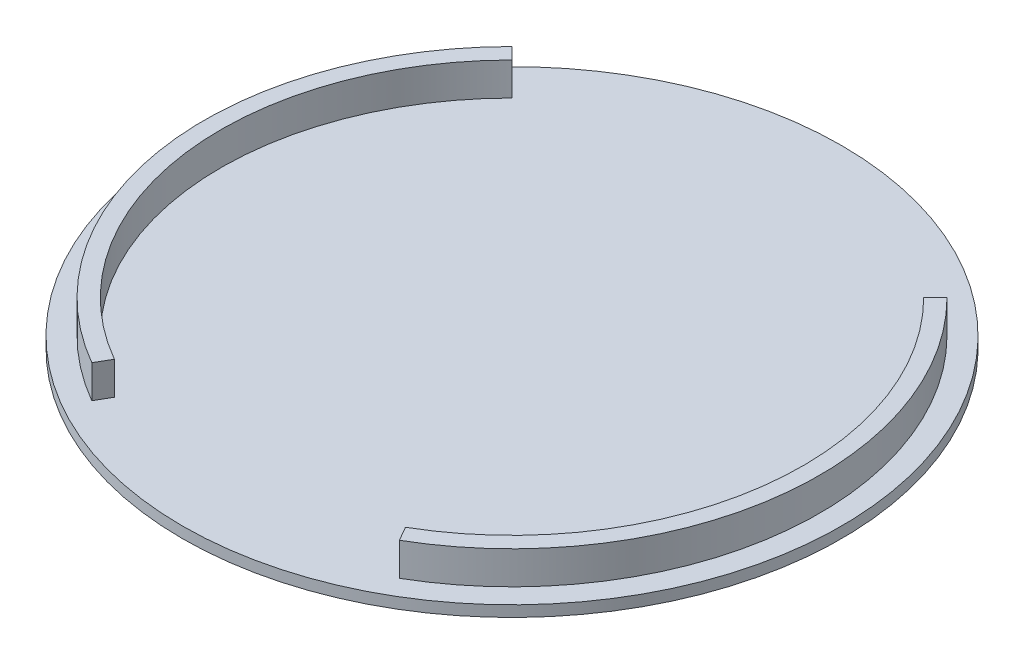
SolidWorks part; units mm, degrees
ref_plane "Plan de face" through (0, 0, 0) normal (0, 0, 1) x (1, 0, 0)
ref_plane "Plan de dessus" through (0, 0, 0) normal (0, 1, 0) x (1, 0, 0)
ref_plane "Plan de droite" through (0, 0, 0) normal (1, 0, 0) x (0, 0, -1)
sketch "Esquisse1" plane through (0, 0, 0) normal (0, 1, 0) x (1, 0, 0)
  circle A0 centre (0, 0) radius 60
  dimension "D1" = 120
extrude "Boss.-Extru.1" add sketch "Esquisse1" along normal blind 2
sketch "Esquisse2" plane through (0, 2, 0) normal (0, 1, 0) x (1, 0, 0)
  line L0 (0, 0) -> (0, 36.8878) construction
  line L1 (0, 0) -> (-42.4264, 42.4264) construction
  line L2 (0, 0) -> (42.4264, 42.4264) construction
  line L3 (0, 0) -> (-30, -51.9615) construction
  line L4 (0, 0) -> (30, -51.9615) construction
  line L5 (-39.598, 39.598) -> (-37.4767, 37.4767)
  line L6 (-28, -48.4974) -> (-26.5, -45.8993)
  line L7 (37.4767, 37.4767) -> (39.598, 39.598)
  line L8 (26.5, -45.8993) -> (28, -48.4974)
  circle A0 centre (0, 0) radius 60 construction
  arc A1 (39.598, 39.598) -> (28, -48.4974) centre (0, 0) cw
  arc A2 (-39.598, 39.598) -> (-28, -48.4974) centre (0, 0) ccw
  arc A3 (-37.4767, 37.4767) -> (-26.5, -45.8993) centre (0, 0) ccw
  arc A4 (37.4767, 37.4767) -> (26.5, -45.8993) centre (0, 0) cw
  dimension "D5" = 56
  dimension "D6" = 53
  dimension "D7" = 56
  dimension "D8" = 53
  dimension "D1" = 45
  dimension "D2" = 45
  dimension "D3" = 30
  dimension "D4" = 30
extrude "Boss.-Extru.2" add sketch "Esquisse2" along normal blind 6
sketch "Esquisse3" plane through (0, 0, 0) normal (0, -1, 0) x (1, 0, 0)
  line L0 (0, 0) -> (0, -27.058) construction
  line L1 (0, 0) -> (21.7081, 0) construction
  line L3 (-38, 38) -> (-28, 38)
  line L4 (-38, 38) -> (-38, 28)
  line L5 (-38, 28) -> (-28, 28)
  line L6 (-28, 38) -> (-28, 28)
  line L7 (28, 38) -> (38, 38)
  line L8 (28, 38) -> (28, 28)
  line L9 (28, 28) -> (38, 28)
  line L10 (38, 38) -> (38, 28)
  line L11 (38, -28) -> (28, -28)
  line L12 (38, -28) -> (38, -38)
  line L13 (38, -38) -> (28, -38)
  line L14 (28, -28) -> (28, -38)
  line L15 (-28, -38) -> (-38, -38)
  line L16 (-28, -38) -> (-28, -28)
  line L17 (-28, -28) -> (-38, -28)
  line L18 (-38, -38) -> (-38, -28)
  point P20 (33, -28)
  point P21 (28, 33)
  point P22 (28, -33)
  dimension "D1" = 56
  dimension "D2" = 10
  dimension "D3" = 10
  dimension "D4" = 28
  dimension "D5" = 10
  dimension "D6" = 10
  dimension "D7" = 10
  dimension "D8" = 28
  dimension "D9" = 10
  dimension "D10" = 10
  dimension "D11" = 56
extrude "Enlèv. mat.-Extru.2" cut sketch "Esquisse3" against normal blind 1
